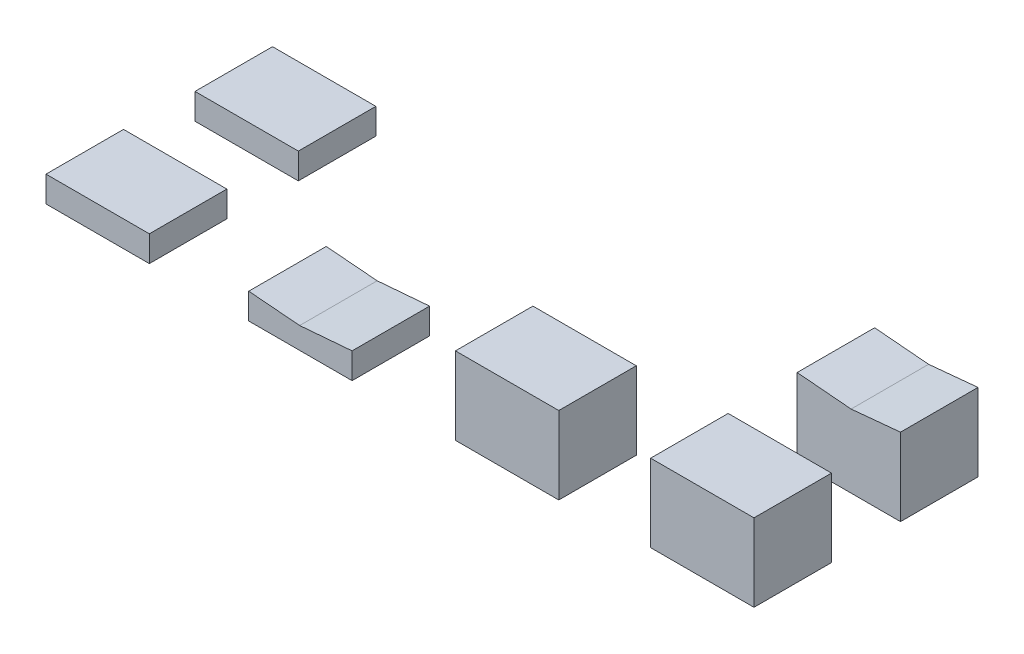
SolidWorks part; units mm, degrees
ref_plane "Front Plane" through (0, 0, 0) normal (0, 0, 1) x (1, 0, 0)
ref_plane "Top Plane" through (0, 0, 0) normal (0, 1, 0) x (1, 0, 0)
ref_plane "Right Plane" through (0, 0, 0) normal (1, 0, 0) x (0, 0, -1)
sketch "Sketch1" plane through (0, 0, 0) normal (0, 1, 0) x (1, 0, 0)
  line L1 (100, -75) -> (-100, -75)
  line L2 (100, -75) -> (100, 75)
  line L3 (100, 75) -> (-100, 75)
  line L4 (-100, -75) -> (-100, 75)
  line L5 (100, -75) -> (-100, 75) construction
  line L6 (100, 75) -> (-100, -75) construction
  point P0 (0, 0)
  dimension "D1" = 200
  dimension "D2" = 150
extrude "Boss-Extrude1" add sketch "Sketch1" along normal blind 50
sketch "Sketch5" plane through (0, 0, 0) normal (0, 1, 0) x (1, 0, 0)
  line L1 (868.7672, -65.9807) -> (668.7672, -65.9807)
  line L2 (868.7672, -65.9807) -> (868.7672, 84.0193)
  line L3 (868.7672, 84.0193) -> (668.7672, 84.0193)
  line L4 (668.7672, -65.9807) -> (668.7672, 84.0193)
  line L5 (868.7672, -65.9807) -> (668.7672, 84.0193) construction
  line L6 (868.7672, 84.0193) -> (668.7672, -65.9807) construction
  point P0 (768.7672, 9.0193)
  dimension "D1" = 200
  dimension "D2" = 150
extrude "Boss-Extrude3" add sketch "Sketch5" along normal blind 150 separate body
sketch "Sketch10" plane through (0, 0, 0) normal (0, 1, 0) x (1, 0, 0)
  line L1 (666.9226, 369.3818) -> (866.9226, 369.3818)
  line L2 (666.9226, 369.3818) -> (666.9226, 219.3818)
  line L3 (666.9226, 219.3818) -> (866.9226, 219.3818)
  line L4 (866.9226, 369.3818) -> (866.9226, 219.3818)
  line L5 (666.9226, 369.3818) -> (866.9226, 219.3818) construction
  line L6 (666.9226, 219.3818) -> (866.9226, 369.3818) construction
  point P0 (766.9226, 294.3818)
  dimension "D1" = 200
  dimension "D2" = 150
extrude "Boss-Extrude4" add sketch "Sketch10" along normal blind 150 separate body
sketch "Sketch14" plane through (0, 0, -219.3818) normal (0, 0, 1) x (1, 0, 0)
  line L3 (866.9226, 150) -> (666.9226, 150)
  line L6 (666.9226, 150) -> (771.3272, 140.9367)
  line L7 (771.3272, 140.9367) -> (866.9226, 150)
extrude "Cut-Extrude1" cut sketch "Sketch14" against normal blind 150
sketch "Sketch15" plane through (0, 0, 75) normal (0, 0, 1) x (1, 0, 0)
  line L0 (100, 50) -> (-100, 50)
  line L1 (-100, 50) -> (100, 50) construction
  line L3 (100, 50) -> (100, 0) construction
  line L4 (100, 50) -> (-1.4414, 41.7122)
  line L5 (-1.4414, 41.7122) -> (-100, 50)
extrude "Cut-Extrude2" cut sketch "Sketch15" against normal blind 150
sketch "Sketch2" plane through (0, 0, 0) normal (0, 0, 1) x (1, 0, 0)
  spline S0 degree 3 poles (-112.3806, 133.5488) (-74.5383, 121.531) (-2.3314, 122.6466) (67.394, 149.565) (98.455, 128.6457) knots 0 0 0 0 0.545578 1 1 1 1
surface "Surface-Extrude1" sketch "Sketch2" parameters "D1"=100
sketch "Sketch3" plane through (0, 0, 0) normal (0, 1, 0) x (1, 0, 0)
  line L1 (500, -75) -> (300, -75)
  line L2 (500, -75) -> (500, 75)
  line L3 (500, 75) -> (300, 75)
  line L4 (300, -75) -> (300, 75)
  line L5 (500, -75) -> (300, 75) construction
  line L6 (500, 75) -> (300, -75) construction
  point P0 (400, 0)
  dimension "D1" = 200
  dimension "D2" = 150
  dimension "D3" = 300
sketch "Sketch4" plane through (0, 0, 0) normal (0, 0, 1) x (1, 0, 0)
  spline S0 degree 2 poles (243.4306, 108.4268) (391.7625, 32.01) (539.9781, 105.9487) knots 0 0 0 1 1 1
surface "Surface-Extrude2" sketch "Sketch4" parameters "D1"=100
sketch "Sketch6" plane through (0, 0, 0) normal (0, 0, 1) x (1, 0, 0)
  spline S0 degree 2 poles (643.353, 121.0698) (770.4469, 42.1415) (893.6614, 120.4996) knots 0 0 0 1 1 1
surface "Surface-Extrude3" sketch "Sketch6" parameters "D1"=200
sketch "Sketch7" plane through (0, 0, 0) normal (0, 1, 0) x (1, 0, 0)
  line L5 (-492.3562, 75) -> (-292.3562, 75)
  line L6 (-492.3562, 75) -> (-492.3562, -75)
  line L7 (-492.3562, -75) -> (-292.3562, -75)
  line L8 (-292.3562, 75) -> (-292.3562, -75)
  line L9 (-492.3562, 75) -> (-292.3562, -75) construction
  line L10 (-492.3562, -75) -> (-292.3562, 75) construction
  point P0 (-392.3562, 0)
  dimension "D1" = 200
  dimension "D2" = 150
surface "Surface-Extrude4" sketch "Sketch7" parameters "D1"=50
sketch "Sketch8" plane through (0, 0, 0) normal (0, 0, 1) x (1, 0, 0)
  spline S0 degree 3 poles (-517.3881, 129.4727) (-431.6352, 85.6501) (-340.939, 177.249) (-260.8383, 119.086) knots 0 0 0 0 1 1 1 1
surface "Surface-Extrude5" sketch "Sketch8" parameters "D1"=200
surface "Surface-Extrude6" sketch "Sketch3" parameters "D1"=150
sketch "Sketch9" plane through (0, 0, 0) normal (0, 1, 0) x (1, 0, 0)
  line L1 (-486.8143, 357.7998) -> (-286.8143, 357.7998)
  line L2 (-486.8143, 357.7998) -> (-486.8143, 207.7998)
  line L3 (-486.8143, 207.7998) -> (-286.8143, 207.7998)
  line L4 (-286.8143, 357.7998) -> (-286.8143, 207.7998)
  line L5 (-486.8143, 357.7998) -> (-286.8143, 207.7998) construction
  line L6 (-486.8143, 207.7998) -> (-286.8143, 357.7998) construction
  point P0 (-386.8143, 282.7998)
  dimension "D1" = 150
  dimension "D2" = 200
surface "Surface-Extrude7" sketch "Sketch9" parameters "D1"=50
